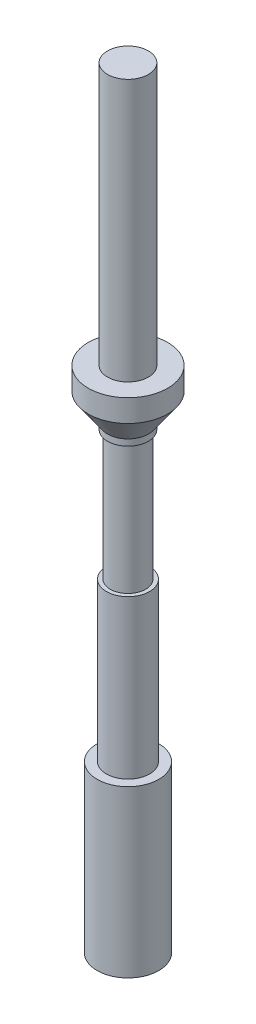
SolidWorks part; units mm, degrees
ref_plane "Front Plane" through (0, 0, 0) normal (0, 0, 1) x (1, 0, 0)
ref_plane "Top Plane" through (0, 0, 0) normal (0, 1, 0) x (1, 0, 0)
ref_plane "Right Plane" through (0, 0, 0) normal (1, 0, 0) x (0, 0, -1)
sketch "Sketch1" plane through (0, 0, 0) normal (0, 0, 1) x (1, 0, 0)
  line L0 (0, 0) -> (2.65, 0)
  line L1 (2.65, 0) -> (2.65, -34)
  line L2 (2.65, -34) -> (5.15, -34)
  line L3 (5.15, -34) -> (5.15, -36.9)
  line L4 (5.15, -36.9) -> (2.65, -40.4)
  line L5 (2.65, -40.4) -> (2.65, -41.2103)
  line L6 (2.65, -41.2103) -> (2.3, -41.2103)
  line L7 (2.3, -41.2103) -> (2.3, -58.0103)
  line L14 (2.3, -58.0103) -> (2.8, -58.0103)
  line L15 (2.8, -58.0103) -> (2.8, -78.5103)
  line L16 (0, 0) -> (0, -100)
  line L17 (2.8, -78.5103) -> (4, -78.5103)
  line L18 (4, -78.5103) -> (4, -100)
  line L19 (4, -100) -> (0, -100)
  dimension "D1" = 2.65
  dimension "D2" = 34
  dimension "D3" = 2.5
  dimension "D4" = 2.9
  dimension "D5" = 3.5
  dimension "D6" = 2.5
  dimension "D7" = 0.35
  dimension "D8" = 16.8
  dimension "D9" = 20.5
  dimension "D10" = 100
  dimension "D11" = 4
  dimension "D12" = 2.8
revolve "Revolve1" add sketch "Sketch1" angle 360 about L16
sketch3d "3DSketch1"
  circle A0 centre (0, -90, 0) radius 3.9594
  point P2 (0, -93.9594, 0)
  dimension "D1" = 10
